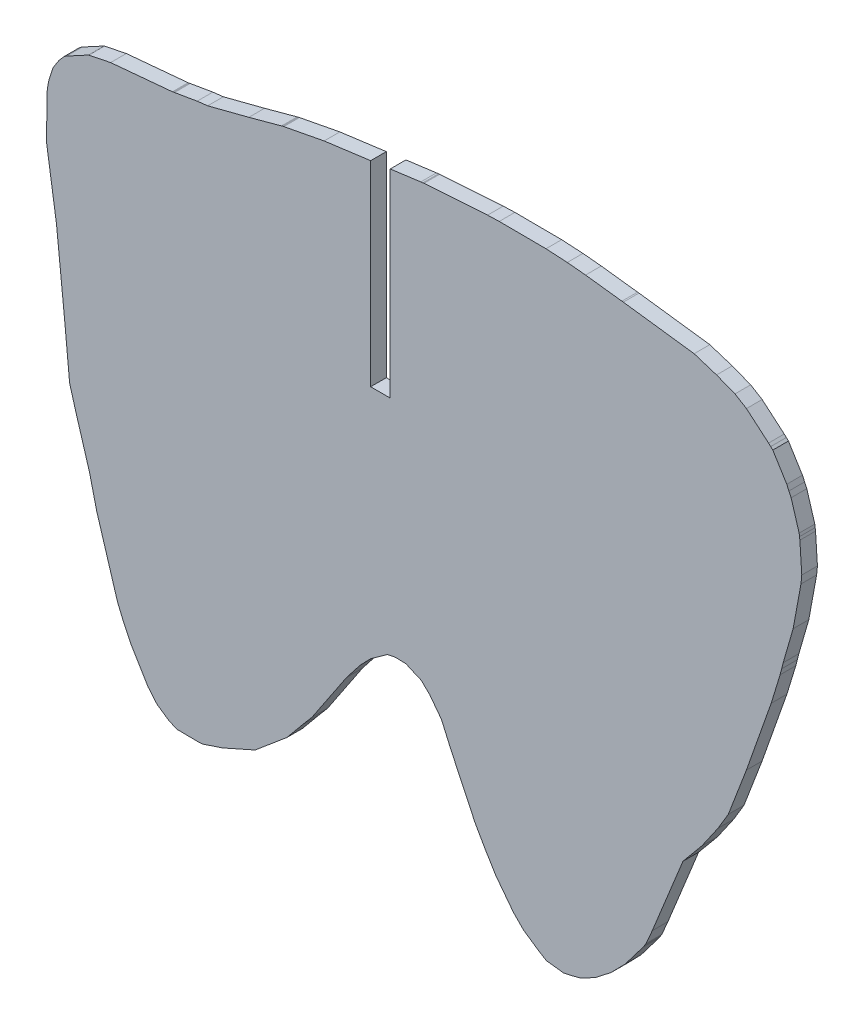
SolidWorks part; units mm, degrees
ref_plane "Спереди" through (0, 0, 0) normal (0, 0, 1) x (1, 0, 0)
ref_plane "Сверху" through (0, 0, 0) normal (0, 1, 0) x (1, 0, 0)
ref_plane "Справа" through (0, 0, 0) normal (1, 0, 0) x (0, 0, -1)
sketch "Model" plane through (0, 0, 0) normal (0, 0, 1) x (1, 0, 0)
  line L0 (-6235.5982, 41.9604) -> (-6235.6612, 41.9386)
  line L1 (-6235.6612, 41.9386) -> (-6238.4369, 40.4371)
  line L2 (-6238.4369, 40.4371) -> (-6238.5915, 40.3384)
  line L3 (-6238.5915, 40.3384) -> (-6238.7461, 40.2397)
  line L4 (-6238.7461, 40.2397) -> (-6239.4378, 39.4428)
  line L5 (-6239.4378, 39.4428) -> (-6239.8036, 38.8664)
  line L6 (-6239.8036, 38.8664) -> (-6240.1696, 38.29)
  line L7 (-6240.1696, 38.29) -> (-6240.4391, 37.4668)
  line L8 (-6240.4391, 37.4668) -> (-6240.7088, 36.6436)
  line L9 (-6240.7088, 36.6436) -> (-6240.9129, 35.565)
  line L10 (-6240.9129, 35.565) -> (-6241.0031, 30.697)
  line L11 (-6241.0031, 30.697) -> (-6241.0036, 29.7834)
  line L12 (-6241.0036, 29.7834) -> (-6240.9936, 29.6234)
  line L13 (-6240.9936, 29.6234) -> (-6240.9837, 29.4635)
  line L14 (-6240.9837, 29.4635) -> (-6239.738, 21.2436)
  line L15 (-6239.738, 21.2436) -> (-6238.7133, 11.3128)
  line L16 (-6238.7133, 11.3128) -> (-6238.0612, 4.4888)
  line L17 (-6238.0612, 4.4888) -> (-6237.277, 1.7348)
  line L18 (-6237.277, 1.7348) -> (-6235.5126, -4.1362)
  line L19 (-6235.5126, -4.1362) -> (-6234.5976, -7.9595)
  line L20 (-6234.5976, -7.9595) -> (-6231.9546, -16.6264)
  line L21 (-6231.9546, -16.6264) -> (-6231.1498, -18.5551)
  line L22 (-6231.1498, -18.5551) -> (-6230.2179, -20.4938)
  line L23 (-6230.2179, -20.4938) -> (-6228.0356, -24.11)
  line L24 (-6228.0356, -24.11) -> (-6226.8904, -25.4591)
  line L25 (-6226.8904, -25.4591) -> (-6225.4163, -26.4666)
  line L26 (-6225.4163, -26.4666) -> (-6224.4118, -26.9352)
  line L27 (-6224.4118, -26.9352) -> (-6221.4727, -26.9715)
  line L28 (-6221.4727, -26.9715) -> (-6221.4487, -26.9558)
  line L29 (-6221.4487, -26.9558) -> (-6221.4247, -26.9403)
  line L30 (-6221.4247, -26.9403) -> (-6221.1011, -26.9371)
  line L31 (-6221.1011, -26.9371) -> (-6218.5417, -26.085)
  line L32 (-6218.5417, -26.085) -> (-6214.391, -24.2433)
  line L33 (-6214.391, -24.2433) -> (-6214.3893, -24.2425)
  line L34 (-6214.3893, -24.2425) -> (-6214.3877, -24.2417)
  line L35 (-6214.3877, -24.2417) -> (-6214.3844, -24.2395)
  line L36 (-6214.3844, -24.2395) -> (-6214.381, -24.2372)
  line L37 (-6214.381, -24.2372) -> (-6210.3383, -20.8347)
  line L38 (-6210.3383, -20.8347) -> (-6208.3222, -18.3984)
  line L39 (-6208.3222, -18.3984) -> (-6207.1222, -16.98)
  line L40 (-6207.1222, -16.98) -> (-6202.7052, -10.3726)
  line L41 (-6202.7052, -10.3726) -> (-6200.9755, -8.1567)
  line L42 (-6200.9755, -8.1567) -> (-6199.6473, -6.7815)
  line L43 (-6199.6473, -6.7815) -> (-6197.5055, -5.2456)
  line L44 (-6197.5055, -5.2456) -> (-6196.4748, -5.0386)
  line L45 (-6196.4748, -5.0386) -> (-6195.1233, -5.0841)
  line L46 (-6195.1233, -5.0841) -> (-6193.9513, -5.61)
  line L47 (-6193.9513, -5.61) -> (-6193.1955, -5.9263)
  line L48 (-6193.1955, -5.9263) -> (-6192.111, -6.9652)
  line L49 (-6192.111, -6.9652) -> (-6190.5983, -8.9678)
  line L50 (-6190.5983, -8.9678) -> (-6189.414, -11.6641)
  line L51 (-6189.414, -11.6641) -> (-6186.3141, -18.2414)
  line L52 (-6186.3141, -18.2414) -> (-6185.0726, -20.4302)
  line L53 (-6185.0726, -20.4302) -> (-6183.6814, -22.7249)
  line L54 (-6183.6814, -22.7249) -> (-6181.391, -25.7304)
  line L55 (-6181.391, -25.7304) -> (-6180.1307, -27.0112)
  line L56 (-6180.1307, -27.0112) -> (-6178.2104, -28.3199)
  line L57 (-6178.2104, -28.3199) -> (-6177.2243, -28.933)
  line L58 (-6177.2243, -28.933) -> (-6176.0262, -29.0719)
  line L59 (-6176.0262, -29.0719) -> (-6175.0688, -29.2001)
  line L60 (-6175.0688, -29.2001) -> (-6173.8403, -28.9381)
  line L61 (-6173.8403, -28.9381) -> (-6172.858, -28.6748)
  line L62 (-6172.858, -28.6748) -> (-6170.9992, -27.7061)
  line L63 (-6170.9992, -27.7061) -> (-6168.9512, -26.1184)
  line L64 (-6168.9512, -26.1184) -> (-6167.1227, -24.2421)
  line L65 (-6167.1227, -24.2421) -> (-6164.8326, -21.2258)
  line L66 (-6164.8326, -21.2258) -> (-6164.6586, -20.9507)
  line L67 (-6164.6586, -20.9507) -> (-6164.4845, -20.6756)
  line L68 (-6164.4845, -20.6756) -> (-6163.6996, -18.8669)
  line L69 (-6163.6996, -18.8669) -> (-6159.7782, -9.2284)
  line L70 (-6159.7782, -9.2284) -> (-6157.3643, -6.3177)
  line L71 (-6157.3643, -6.3177) -> (-6155.3017, -3.3414)
  line L72 (-6155.3017, -3.3414) -> (-6153.9913, -1.1466)
  line L73 (-6153.9913, -1.1466) -> (-6151.6836, 4.8912)
  line L74 (-6151.6836, 4.8912) -> (-6148.5182, 13.8629)
  line L75 (-6148.5182, 13.8629) -> (-6147.3837, 17.5757)
  line L76 (-6147.3837, 17.5757) -> (-6147.1869, 18.3381)
  line L77 (-6147.1869, 18.3381) -> (-6146.9903, 19.1005)
  line L78 (-6146.9903, 19.1005) -> (-6145.7166, 23.5069)
  line L79 (-6145.7166, 23.5069) -> (-6144.7184, 28.9464)
  line L80 (-6144.7184, 28.9464) -> (-6144.6164, 29.989)
  line L81 (-6144.6164, 29.989) -> (-6144.8578, 33.72)
  line L82 (-6144.8578, 33.72) -> (-6144.9047, 34.086)
  line L83 (-6144.9047, 34.086) -> (-6144.9517, 34.4519)
  line L84 (-6144.9517, 34.4519) -> (-6145.9756, 37.8528)
  line L85 (-6145.9756, 37.8528) -> (-6146.2536, 38.4603)
  line L86 (-6146.2536, 38.4603) -> (-6146.5314, 39.0678)
  line L87 (-6146.5314, 39.0678) -> (-6148.3145, 41.9499)
  line L88 (-6148.3145, 41.9499) -> (-6148.5854, 42.2025)
  line L89 (-6148.5854, 42.2025) -> (-6148.8564, 42.4551)
  line L90 (-6148.8564, 42.4551) -> (-6151.6764, 44.859)
  line L91 (-6151.6764, 44.859) -> (-6153.1432, 45.7476)
  line L92 (-6153.1432, 45.7476) -> (-6155.4933, 46.6657)
  line L93 (-6155.4933, 46.6657) -> (-6158.3548, 47.5821)
  line L94 (-6158.3548, 47.5821) -> (-6167.3902, 48.7643)
  line L95 (-6167.3902, 48.7643) -> (-6167.5726, 48.7786)
  line L96 (-6167.5726, 48.7786) -> (-6172.2104, 49.3466)
  line L97 (-6172.2104, 49.3466) -> (-6174.5433, 49.5741)
  line L98 (-6174.5433, 49.5741) -> (-6177.2615, 49.7296)
  line L99 (-6177.2615, 49.7296) -> (-6183.2293, 49.7653)
  line L100 (-6183.2293, 49.7653) -> (-6184.7176, 49.7152)
  line L101 (-6184.7176, 49.7152) -> (-6192.8404, 49.1711)
  line L102 (-6192.8404, 49.1711) -> (-6192.9084, 49.1649)
  line L103 (-6192.9084, 49.1649) -> (-6192.9765, 49.1587)
  line L104 (-6192.9765, 49.1587) -> (-6193.2382, 49.128)
  line L105 (-6193.2382, 49.128) -> (-6197.1419, 48.6088)
  line L106 (-6197.1419, 48.6088) -> (-6197.1419, 23.2852)
  line L107 (-6197.1419, 23.2852) -> (-6197.3919, 23.2852)
  line L108 (-6197.3919, 23.2852) -> (-6199.3919, 23.2852)
  line L109 (-6199.3919, 23.2852) -> (-6199.6419, 23.2852)
  line L110 (-6199.6419, 23.2852) -> (-6199.6419, 48.2761)
  line L111 (-6199.6419, 48.2761) -> (-6205.5748, 47.487)
  line L112 (-6205.5748, 47.487) -> (-6210.7258, 46.4992)
  line L113 (-6210.7258, 46.4992) -> (-6210.8371, 46.4778)
  line L114 (-6210.8371, 46.4778) -> (-6210.9483, 46.4564)
  line L115 (-6210.9483, 46.4564) -> (-6210.9809, 46.4415)
  line L116 (-6210.9809, 46.4415) -> (-6211.0136, 46.4267)
  line L117 (-6211.0136, 46.4267) -> (-6215.1836, 45.2961)
  line L118 (-6215.1836, 45.2961) -> (-6220.4397, 43.9389)
  line L119 (-6220.4397, 43.9389) -> (-6221.7803, 43.7822)
  line L120 (-6221.7803, 43.7822) -> (-6224.6756, 43.2913)
  line L121 (-6224.6756, 43.2913) -> (-6224.8078, 43.2661)
  line L122 (-6224.8078, 43.2661) -> (-6224.9401, 43.2409)
  line L123 (-6224.9401, 43.2409) -> (-6232.8252, 42.5248)
  line L124 (-6232.8252, 42.5248) -> (-6235.5982, 41.9604)
extrude "Бобышка-Вытянуть1" add sketch "Model" along normal blind 2
